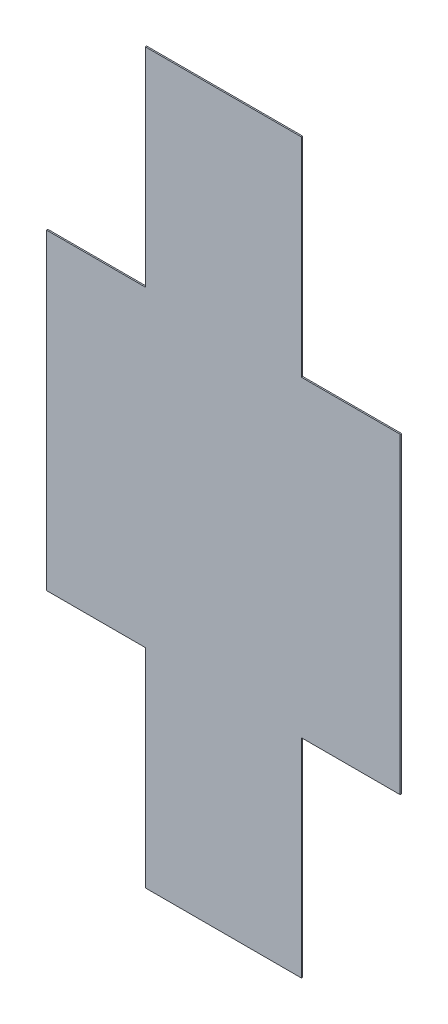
SolidWorks part; units mm, degrees
ref_plane "前基準面" through (0, 0, 0) normal (0, 0, 1) x (1, 0, 0)
ref_plane "上基準面" through (0, 0, 0) normal (0, 1, 0) x (1, 0, 0)
ref_plane "右基準面" through (0, 0, 0) normal (1, 0, 0) x (0, 0, -1)
sketch "草圖1" plane through (0, 0, 0) normal (0, 0, 1) x (1, 0, 0)
  line L1 (-38, 35) -> (38, 35)
  line L2 (-38, 35) -> (-38, -35)
  line L3 (-38, -35) -> (38, -35)
  line L4 (38, 35) -> (38, -35)
  line L5 (-38, 35) -> (38, -35) construction
  line L6 (-38, -35) -> (38, 35) construction
  point P0 (0, 0)
  dimension "D1" = 76
  dimension "D2" = 70
extrude "填料-伸長1" add sketch "草圖1" along normal blind 0.13
sketch "草圖2" plane through (0, 0, 0.13) normal (0, 0, 1) x (1, 0, 0)
  line L0 (0, 35) -> (0, -35) construction
  line L1 (-38, 35) -> (-7.5, 35)
  line L3 (-17, 15) -> (-7.5, 15)
  line L4 (-7.5, 35) -> (-7.5, 15)
  line L5 (38, 35) -> (-38, 35) construction
  line L6 (-38, -35) -> (38, -35) construction
  line L7 (-38, 0) -> (38, 0) construction
  line L8 (-38, 35) -> (-38, -35) construction
  line L9 (38, -35) -> (38, 35) construction
  line L10 (17, 15) -> (7.5, 15)
  line L11 (7.5, 35) -> (7.5, 15)
  line L12 (38, 35) -> (7.5, 35)
  line L15 (38, -35) -> (7.5, -35)
  line L16 (7.5, -35) -> (7.5, -15)
  line L17 (17, -15) -> (7.5, -15)
  line L18 (-17, -15) -> (-7.5, -15)
  line L19 (-7.5, -35) -> (-7.5, -15)
  line L20 (-38, -35) -> (-7.5, -35)
  line L22 (17, -15) -> (17, 15)
  line L23 (-17, -15) -> (-17, 15)
  line L26 (38, 35) -> (38, -35)
  line L27 (-38, 35) -> (-38, -35)
  dimension "D1" = 15
  dimension "D2" = 15
  dimension "D3" = 17
extrude "除料-伸長1" cut sketch "草圖2" against normal through all
